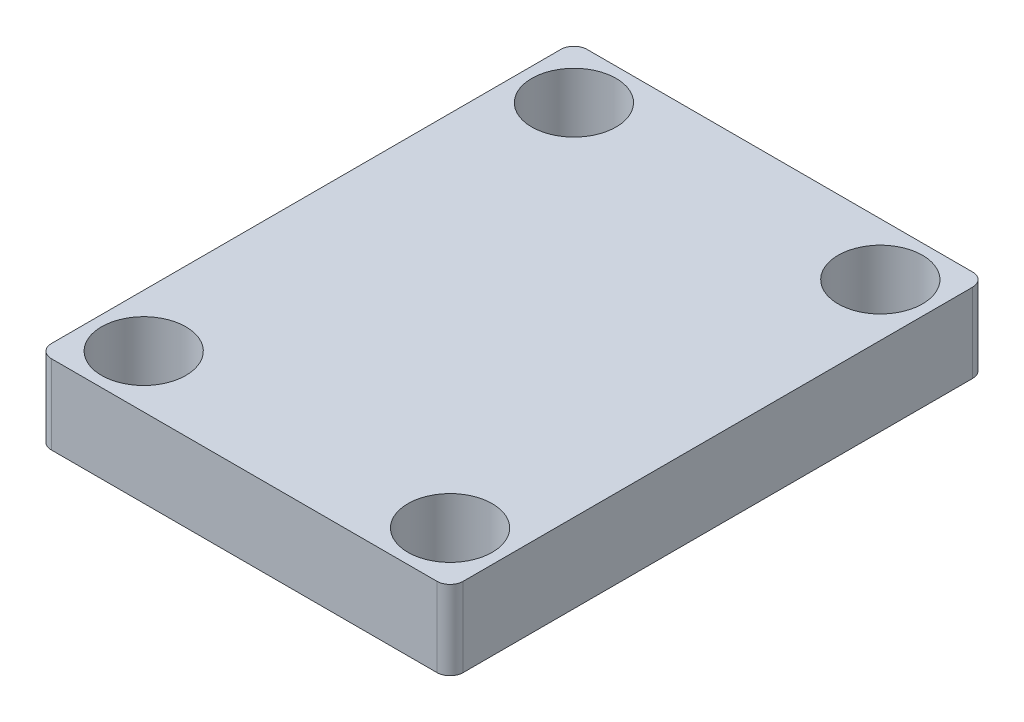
SolidWorks part; units mm, degrees
ref_plane "前视基准面" through (0, 0, 0) normal (0, 0, 1) x (1, 0, 0)
ref_plane "上视基准面" through (0, 0, 0) normal (0, 1, 0) x (1, 0, 0)
ref_plane "右视基准面" through (0, 0, 0) normal (1, 0, 0) x (0, 0, -1)
other "Configuration Table"
sketch "草图1" plane through (0, 0, 0) normal (0, 1, 0) x (1, 0, 0)
  line L0 (0, -10.16) -> (0, 10.16) construction
  line L1 (-7.8105, -10.16) -> (7.8105, -10.16)
  line L2 (-7.8105, -10.16) -> (-7.8105, 10.16)
  line L3 (-7.8105, 10.16) -> (7.8105, 10.16)
  line L4 (7.8105, -10.16) -> (7.8105, 10.16)
  line L5 (-7.8105, -10.16) -> (7.8105, 10.16) construction
  line L6 (-7.8105, 10.16) -> (7.8105, -10.16) construction
  line L7 (-7.8105, 0) -> (7.8105, 0) construction
  circle A0 centre (5.8105, -8.16) radius 1.6
  circle A1 centre (-5.8105, -8.16) radius 1.6
  circle A2 centre (5.8105, 8.16) radius 1.6
  circle A3 centre (-5.8105, 8.16) radius 1.6
  point P0 (0, 0)
  dimension "D3" = 3.2
  dimension "D4" = 2
  dimension "D5" = 2
  dimension "D1" = 15.621
  dimension "D2" = 20.32
extrude "凸台-拉伸1" add sketch "草图1" along normal blind 3
fillet "圆角1" radius 0.5 4 edges at (-7.8105, 1.5, 10.16) (-7.8105, 1.5, -10.16) (7.8105, 1.5, -10.16) (7.8105, 1.5, 10.16)
